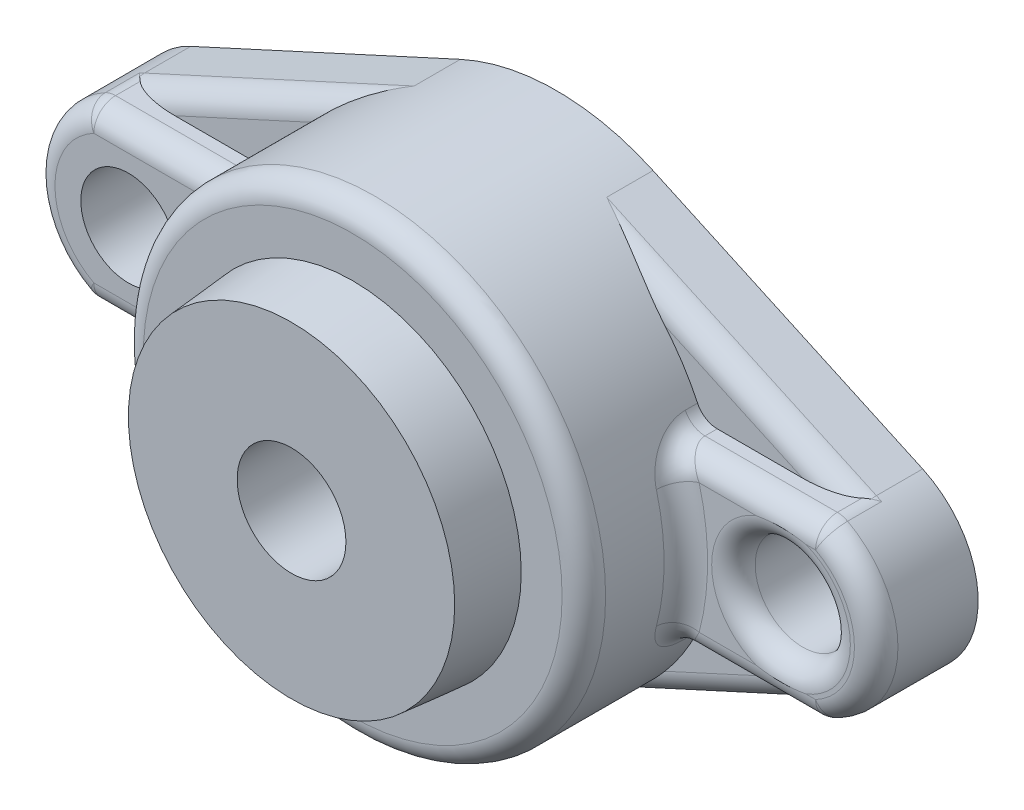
SolidWorks part; units mm, degrees
ref_plane "Front Plane" through (0, 0, 0) normal (0, 0, 1) x (1, 0, 0)
ref_plane "Top Plane" through (0, 0, 0) normal (0, 1, 0) x (1, 0, 0)
ref_plane "Right Plane" through (0, 0, 0) normal (1, 0, 0) x (0, 0, -1)
sketch "Sketch1" plane through (0, 0, 0) normal (0, 0, 1) x (1, 0, 0)
  line L0 (0, 0) -> (-38.1, 0) construction
  line L1 (0, 0) -> (38.1, 0) construction
  line L2 (-42.7302, 10.1019) -> (-11.2448, 24.5332)
  line L3 (11.2448, 24.5332) -> (42.7302, 10.1019)
  line L4 (-42.7302, -10.1019) -> (-11.2448, -24.5332)
  line L5 (11.2448, -24.5332) -> (42.7302, -10.1019)
  circle A0 centre (-38.1, 0) radius 5.5562
  circle A1 centre (38.1, 0) radius 5.5562
  circle A2 centre (0, 0) radius 26.9875 construction
  circle A3 centre (-38.1, 0) radius 11.1125 construction
  circle A4 centre (38.1, 0) radius 11.1125 construction
  arc A5 (-42.7302, 10.1019) -> (-42.7302, -10.1019) centre (-38.1, 0) ccw
  arc A6 (42.7302, 10.1019) -> (42.7302, -10.1019) centre (38.1, 0) cw
  arc A7 (-11.2448, -24.5332) -> (11.2448, -24.5332) centre (0, 0) ccw
  arc A8 (11.2448, 24.5332) -> (-11.2448, 24.5332) centre (0, 0) ccw
  point P17 (-49.2125, 0)
  point P18 (49.2125, 0)
  dimension "D2" = 11.1125
  dimension "D3" = 53.975
  dimension "D4" = 98.425
  dimension "D1" = 76.2
extrude "Boss-Extrude1" add sketch "Sketch1" along normal blind 7.9375
sketch "Sketch2" plane through (0, 0, 0) normal (0, 0, 1) x (1, 0, 0)
  circle A0 centre (0, 0) radius 26.9875
  dimension "D1" = 53.975
extrude "Boss-Extrude2" add sketch "Sketch2" along normal blind 23.8125
sketch "Sketch4" plane through (0, 0, 0) normal (0, 0, 1) x (1, 0, 0)
  circle A0 centre (0, 0) radius 19.05
  dimension "D1" = 38.1
extrude "Boss-Extrude3" add sketch "Sketch4" along normal blind 30.9562
sketch "Sketch5" plane through (0, 0, 0) normal (0, 0, 1) x (1, 0, 0)
  circle A0 centre (0, 0) radius 6.35
  dimension "D1" = 12.7
extrude "Cut-Extrude1" cut sketch "Sketch5" along normal through all
draft "Draft1" type of draft neutral plane draft angle 5 faces to draft 1 parameters "D1"=5
sketch "Sketch6" plane through (0, 0, 7.9375) normal (0, 0, 1) x (1, 0, 0)
  line L0 (-42.7302, 10.1019) -> (-25.0255, 10.1019)
  line L1 (-42.7302, -10.1019) -> (-25.0255, -10.1019)
  line L2 (42.7302, -10.1019) -> (25.0255, -10.1019)
  line L3 (42.7302, 10.1019) -> (25.0255, 10.1019)
  line L6 (-42.7302, -10.1019) -> (-11.2448, -24.5332)
  line L7 (-42.7302, -10.1019) -> (-11.2448, -24.5332)
  line L8 (-11.2448, 24.5332) -> (-42.7302, 10.1019)
  line L9 (-11.2448, 24.5332) -> (-42.7302, 10.1019)
  arc A0 (42.7302, -10.1019) -> (42.7302, 10.1019) centre (38.1, 0) ccw construction
  arc A1 (-11.2448, 24.5332) -> (-11.2448, -24.5332) centre (0, 0) ccw
  arc A2 (-11.2448, 24.5332) -> (-11.2448, -24.5332) centre (0, 0) ccw
  circle A3 centre (38.1, 0) radius 5.5563 construction
  circle A4 centre (-38.1, 0) radius 5.5562 construction
  arc A5 (42.7302, -10.1019) -> (42.7302, 10.1019) centre (38.1, 0) ccw
  circle A6 centre (38.1, 0) radius 5.5563
  circle A7 centre (-38.1, 0) radius 5.5562
  arc A8 (-42.7302, 10.1019) -> (-42.7302, -10.1019) centre (-38.1, 0) ccw construction
  arc A9 (-42.7302, 10.1019) -> (-42.7302, -10.1019) centre (-38.1, 0) ccw
  circle A10 centre (0, 0) radius 26.9875 construction
  arc A11 (-25.0255, 10.1019) -> (-25.0255, -10.1019) centre (0, 0) ccw
  arc A12 (25.0255, -10.1019) -> (25.0255, 10.1019) centre (0, 0) ccw
  arc A15 (-42.7302, 10.1019) -> (-42.7302, -10.1019) centre (-38.1, 0) ccw
  arc A16 (-42.7302, 10.1019) -> (-42.7302, -10.1019) centre (-38.1, 0) ccw
  dimension "D1" = 0
extrude "Boss-Extrude4" add sketch "Sketch6" along normal blind 3.9688 contours A12 L2 A5 L3 A6 | L1 L0 M6 M4 M2
fillet "Fillet2" radius 2.54 4 edges at (42.7302, 10.1019, 9.9219) (42.7302, -10.1019, 9.9219) (-42.7302, -10.1019, 9.9219) (-42.7302, 10.1019, 9.9219)
fillet "Fillet3" radius 2.54 17 edges at (-25.0255, 10.1019, 9.9219) (-25.0255, -10.1019, 9.9219) (25.0255, -10.1019, 9.9219) (25.0255, 10.1019, 9.9219) (-42.7546, 10.0259, 11.9062) (-33.5817, 10.1019, 11.9062) (-26.9875, 0, 11.9062) (-33.5817, -10.1019, 11.9062) (-42.7546, -10.0259, 11.9062) (-49.2125, 0, 11.9062) (43.6562, 0, 11.9062) (42.7546, -10.0259, 11.9062) (33.5817, -10.1019, 11.9062) (26.9875, 0, 11.9062) (33.5817, 10.1019, 11.9062) (42.7546, 10.0259, 11.9062) (49.2125, 0, 11.9062)
fillet "Fillet4" radius 2.54 9 edges at (-43.0346, 9.9568, 7.9375) (-43.0346, -9.9568, 7.9375) (43.0346, -9.9568, 7.9375) (43.0346, 9.9568, 7.9375) (-26.9875, 17.3176, 7.9375) (-26.9875, -17.3176, 7.9375) (26.9875, -17.3176, 7.9375) (26.9875, 0, 23.8125) (26.9875, 17.3176, 7.9375)
